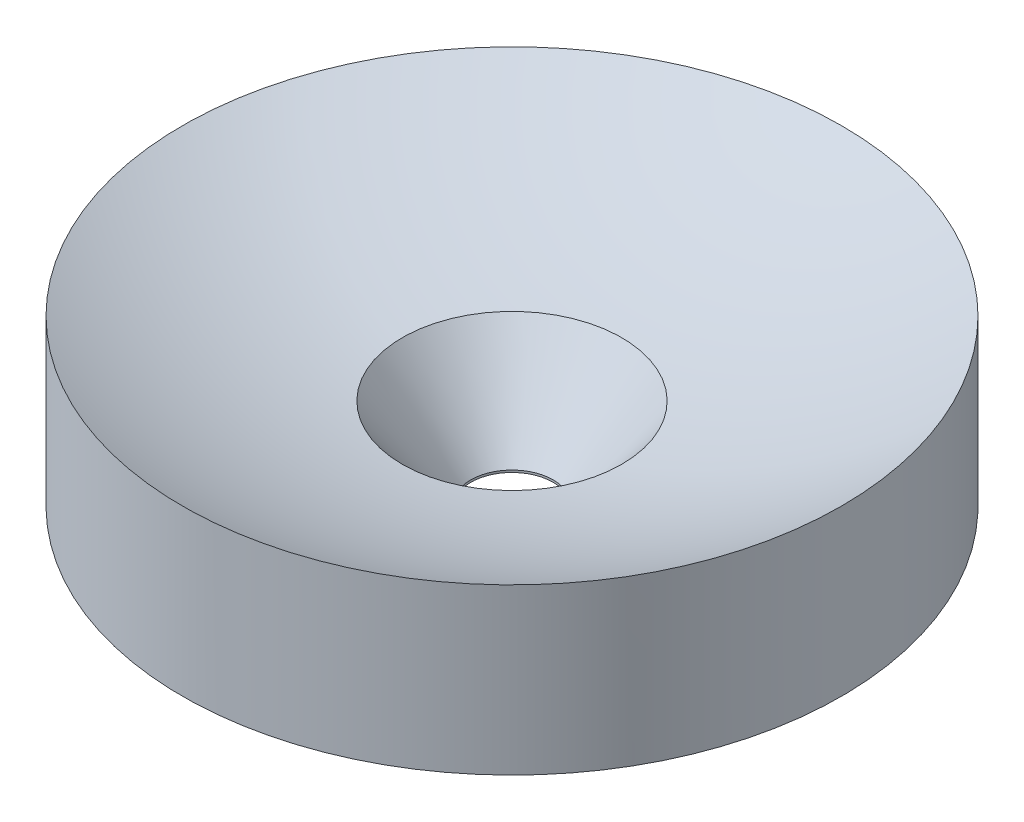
SolidWorks part; units mm, degrees
ref_plane "Front Plane" through (0, 0, 0) normal (0, 0, 1) x (1, 0, 0)
ref_plane "Top Plane" through (0, 0, 0) normal (0, 1, 0) x (1, 0, 0)
ref_plane "Right Plane" through (0, 0, 0) normal (1, 0, 0) x (0, 0, -1)
sketch "Sketch1" plane through (0, 0, 0) normal (0, 0, 1) x (1, 0, 0)
  line L3 (0, 0) -> (25.4, 0)
  line L4 (25.4, 0) -> (25.4, 12.7)
  line L5 (0, 0) -> (0, 6.35)
  arc A0 (0, 6.35) -> (25.4, 12.7) centre (0, 60.325) ccw
  dimension "D1" = 25.4
  dimension "D4" = 12.7
  dimension "D5" = 6.35
revolve "Revolve1" add sketch "Sketch1" angle 360 about L5
hole_wizard "1/4 (0.25) Diameter Hole3" positions "3DSketch4" profile "Sketch5" hole size "1/4" standard "Ansi Inch"
sketch3d "3DSketch4"
  point P0 (0, 0, 0)
sketch "Sketch5" plane through (0, 0, 0) normal (1, 0, 0) x (0, 0, -1)
  line L0 (0, 0) -> (0, 23.4977)
  line L1 (0, 23.4977) -> (3.175, 21.59)
  line L2 (3.175, 21.59) -> (3.175, 0)
  line L5 (3.175, 0) -> (0, 0)
  line L10 (0, 23.4977) -> (-3.175, 21.59) construction
  line L11 (0, -6.35) -> (0, 107.95) construction
  dimension "Hole Dia." = 6.35
  dimension "Hole Depth" = 21.59
  dimension "Drill Angle" = 118
chamfer "Chamfer2" distance 5.08 angle 49 1 edges at (0, 6.4435, 3.175)
